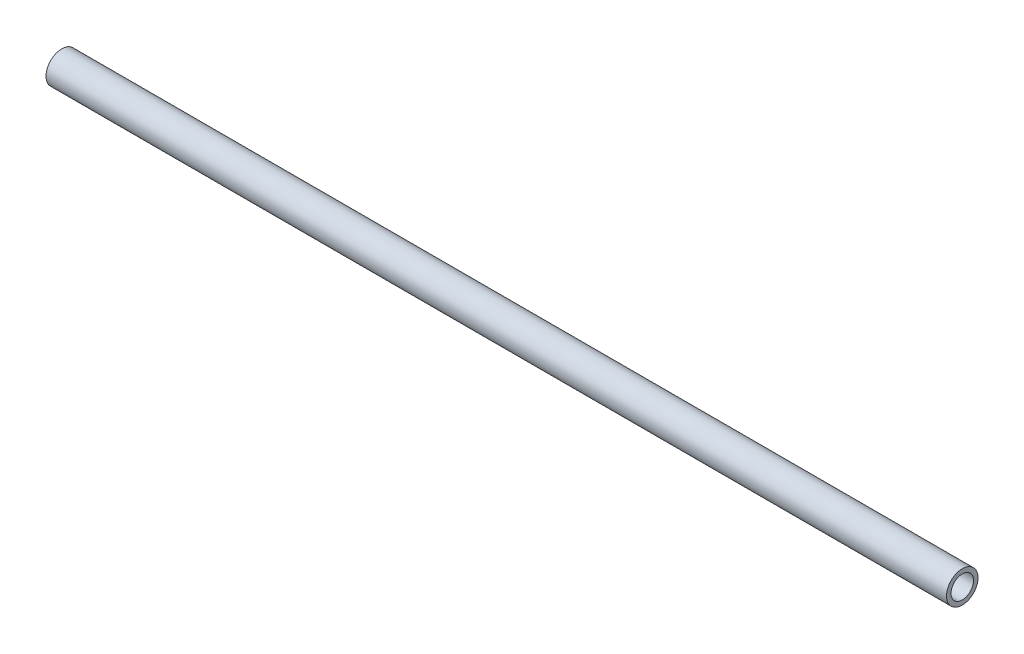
SolidWorks part; units mm, degrees
ref_plane "Front" through (0, 0, 0) normal (0, 0, 1) x (1, 0, 0)
ref_plane "Top" through (0, 0, 0) normal (0, 1, 0) x (1, 0, 0)
ref_plane "Right" through (0, 0, 0) normal (1, 0, 0) x (0, 0, -1)
sketch "Sketch1" plane through (0, 0, 0) normal (0, 0, 1) x (1, 0, 0)
  line L0 (0, 0) -> (609.6, 0)
  line L1 (9.9848, 0) -> (-9.9848, 0) construction
  dimension "D1" = 609.6
other "Structural Member1"
ref_plane "Plane1" through (0, 0, 0) normal (1, 0, 0) x (0, 0, -1)
sketch "Sketch11" plane through (0, 0, 0) normal (1, 0, 0) x (0, 0, -1)
  circle A0 centre (0, 0) radius 7.62
  circle A1 centre (0, 0) radius 10.668
  point P3 (0, 0)
  dimension "D1" = 21.336
  dimension "D2" = 15.24
